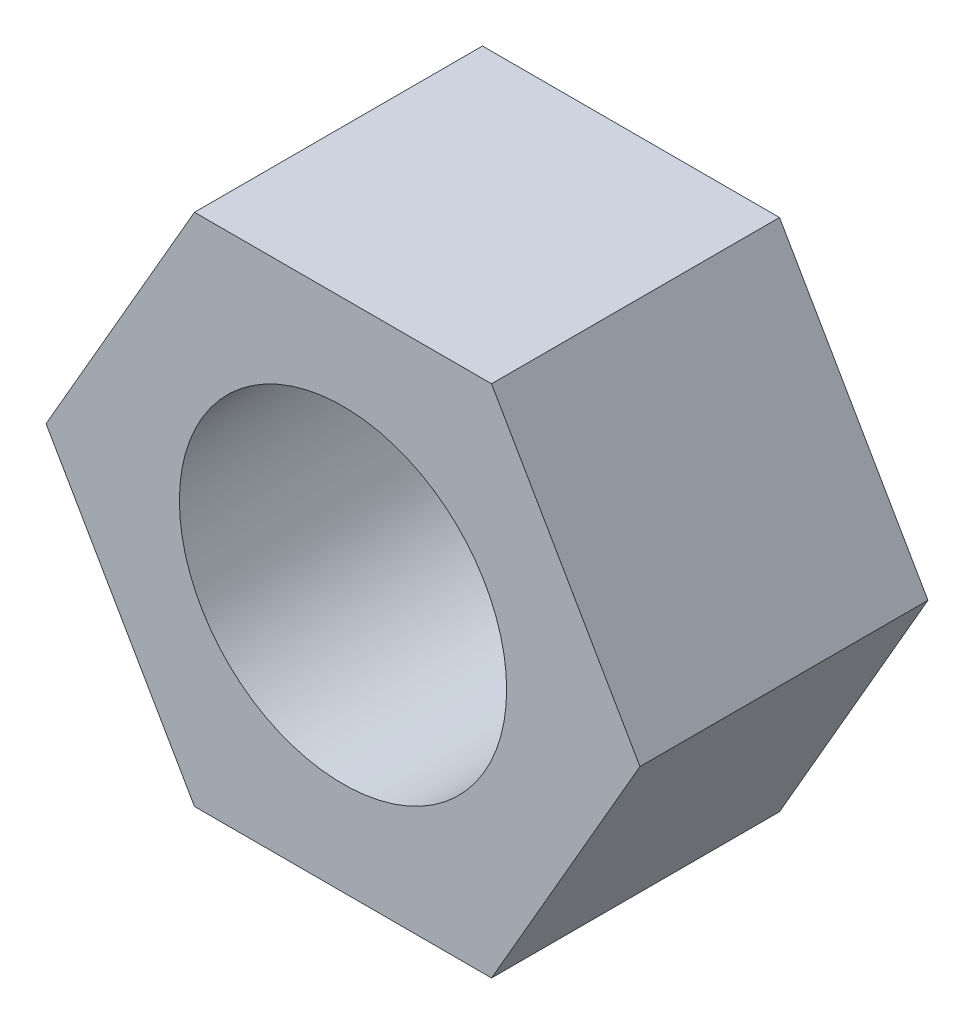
SolidWorks part; units mm, degrees
ref_plane "Front" through (0, 0, 0) normal (0, 0, 1) x (1, 0, 0)
ref_plane "Top" through (0, 0, 0) normal (0, 1, 0) x (1, 0, 0)
ref_plane "Right" through (0, 0, 0) normal (1, 0, 0) x (0, 0, -1)
sketch "Sketch1" plane through (0, 0, 0) normal (0, 0, 1) x (1, 0, 0)
  line L0 (0, 36.9968) -> (0, -40.2525) construction
  line L1 (-50.3157, 0) -> (49.1318, 0) construction
  line L2 (5.0436, 8.7376) -> (-5.0436, 8.7376)
  line L3 (-5.0436, 8.7376) -> (-10.0838, 0)
  line L4 (5.0436, 8.7376) -> (10.0838, 0)
  line L5 (5.0436, -8.7376) -> (10.0838, 0)
  line L6 (-5.0436, -8.7376) -> (-10.0838, 0)
  line L7 (5.0436, -8.7376) -> (-5.0436, -8.7376)
  point P9 (0, 8.7376)
  point P12 (0, -8.7376)
  dimension "D1" = 17.4752
  dimension "D2" = 20.1676
extrude "Extrude1" add sketch "Sketch1" along normal blind 9.779
sketch "Sketch2" plane through (0, 0, 9.779) normal (0, 0, 1) x (1, 0, 0)
  circle A0 centre (0, 0) radius 5.5562
  dimension "D1" = 11.1125
extrude "Cut-Extrude1" cut sketch "Sketch2" against normal through all
